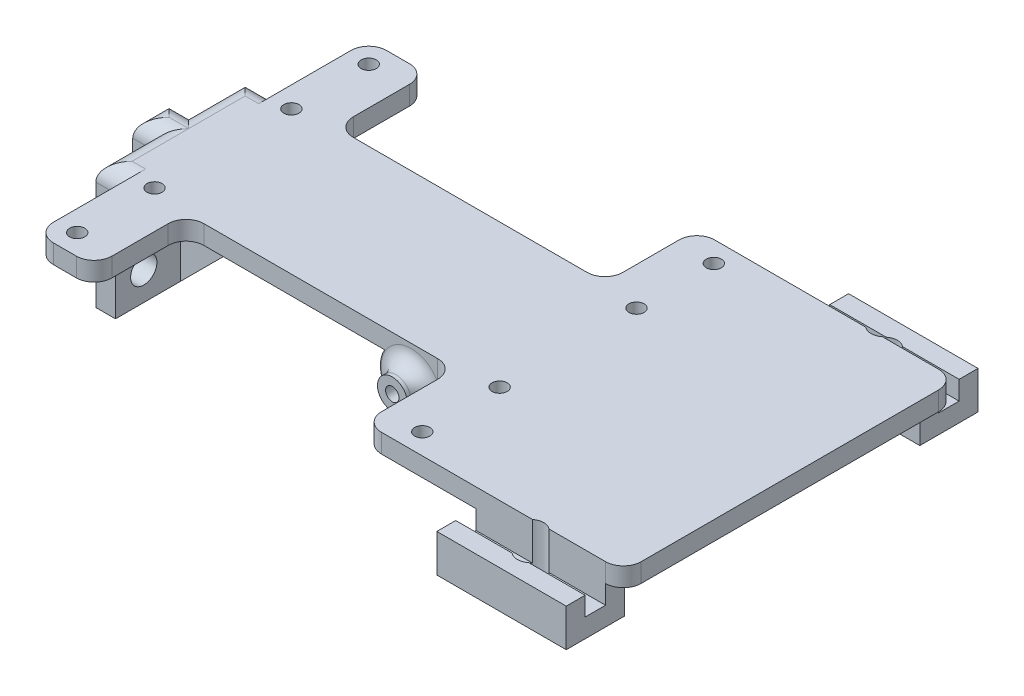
SolidWorks part; units mm, degrees
ref_plane "Front Plane" through (0, 0, 0) normal (0, 0, 1) x (1, 0, 0)
ref_plane "Top Plane" through (0, 0, 0) normal (0, 1, 0) x (1, 0, 0)
ref_plane "Right Plane" through (0, 0, 0) normal (1, 0, 0) x (0, 0, -1)
sketch "Sketch2" plane through (0, 0, 0) normal (0, 1, 0) x (1, 0, 0)
  line L0 (9.8501, 52.9996) -> (9.8501, 43.5508)
  line L1 (2.9997, 0) -> (6.8504, 0)
  line L2 (0, 2.9997) -> (0, 52.9996)
  line L3 (2.9997, 55.9994) -> (6.8504, 55.9994)
  line L4 (98.7996, 2.9997) -> (98.7996, 52.9996)
  line L5 (12.8499, 40.5511) -> (52.1513, 40.5511)
  line L6 (55.151, 43.5508) -> (55.151, 52.9996)
  line L7 (9.8501, 2.9997) -> (9.8501, 12.4485)
  line L8 (12.8499, 15.4483) -> (52.1513, 15.4483)
  line L9 (55.151, 12.4485) -> (55.151, 2.9997)
  line L10 (58.1508, 55.9994) -> (95.7999, 55.9994)
  line L11 (58.1508, 0) -> (95.7999, 0)
  arc A0 (2.9997, 0) -> (0, 2.9997) centre (2.9997, 2.9997) cw
  arc A1 (95.7999, 0) -> (98.7996, 2.9997) centre (95.7999, 2.9997) ccw
  arc A2 (95.7999, 55.9994) -> (98.7996, 52.9996) centre (95.7999, 52.9996) cw
  arc A3 (0, 52.9996) -> (2.9997, 55.9994) centre (2.9997, 52.9996) cw
  circle A4 centre (3.5001, 52.4993) radius 1.27
  circle A5 centre (61.501, 52.4993) radius 1.27
  circle A6 centre (61.501, 3.5001) radius 1.27
  circle A7 centre (3.5001, 3.5001) radius 1.27
  arc A8 (55.151, 52.9996) -> (58.1508, 55.9994) centre (58.1508, 52.9996) cw
  arc A9 (9.8501, 52.9996) -> (6.8504, 55.9994) centre (6.8504, 52.9996) ccw
  arc A10 (9.8501, 2.9997) -> (6.8504, 0) centre (6.8504, 2.9997) cw
  arc A11 (55.151, 2.9997) -> (58.1508, 0) centre (58.1508, 2.9997) ccw
  arc A12 (9.8501, 12.4485) -> (12.8499, 15.4483) centre (12.8499, 12.4485) cw
  arc A13 (52.1513, 15.4483) -> (55.151, 12.4485) centre (52.1513, 12.4485) cw
  arc A14 (52.1513, 40.5511) -> (55.151, 43.5508) centre (52.1513, 43.5508) ccw
  arc A15 (9.8501, 43.5508) -> (12.8499, 40.5511) centre (12.8499, 43.5508) ccw
  point P7 (0, 0)
  point P12 (98.7996, 55.9994)
  point P15 (0, 55.9994)
  point P34 (55.151, 55.9994)
  point P41 (55.151, 0)
  point P50 (9.8501, 40.5511)
  dimension "D3" = 2.9997
  dimension "D12" = 2.54
  dimension "D16" = 2.9997
  dimension "D1" = 55.9994
  dimension "D2" = 98.7996
  dimension "D6" = 3.5001
  dimension "D7" = 3.5001
  dimension "D8" = 3.5001
  dimension "D9" = 3.5001
  dimension "D10" = 58.0009
  dimension "D11" = 3.5001
  dimension "D13" = 25.1028
  dimension "D14" = 6.35
  dimension "D15" = 6.35
  dimension "D4" = 2
  dimension "D5" = 2
extrude "Boss-Extrude1" add sketch "Sketch2" along normal blind 3.175
sketch "Sketch3" plane through (0, 3.175, 0) normal (0, 1, 0) x (1, 0, 0)
  circle A0 centre (3.5001, 52.4993) radius 2.9997
  circle A1 centre (3.5001, 3.5001) radius 2.9997
  circle A2 centre (61.501, 52.4993) radius 2.9997
  circle A3 centre (61.501, 3.5001) radius 2.9997
  circle A4 centre (61.501, 52.4993) radius 1.27 construction
  circle A5 centre (61.501, 3.5001) radius 1.27 construction
  circle A6 centre (3.5001, 3.5001) radius 1.27 construction
  circle A7 centre (3.5001, 52.4993) radius 1.27 construction
  circle A8 centre (61.501, 52.4993) radius 1.27
  circle A9 centre (61.501, 3.5001) radius 1.27
  circle A10 centre (3.5001, 3.5001) radius 1.27
  circle A11 centre (3.5001, 52.4993) radius 1.27
  dimension "D1" = 5.9995
sketch "Sketch5" plane through (0, 0, -15.4483) normal (0, 0, 1) x (1, 0, 0)
  line L0 (0, 0) -> (98.7996, 0) construction
  line L2 (43.2316, 0) -> (52.1513, 0)
  circle A1 centre (47.6915, -2.625) radius 2.254
  circle A3 centre (47.6915, -2.625) radius 2.625 construction
  arc A4 (43.2316, 0) -> (52.1513, 0) centre (47.6915, -2.625) ccw
  dimension "D1" = 5.175
  dimension "D2" = 5.25
  dimension "D3" = 4.508
sketch "Sketch7" plane through (0, 0, -40.5511) normal (0, 0, -1) x (-1, 0, 0)
  line L0 (0, 0) -> (-98.7996, 0) construction
  line L1 (-1.8212, 0) -> (-20.8407, 0)
  line L2 (-61.8211, 0) -> (-80.8406, 0)
  arc A0 (-16.0858, -4.7549) -> (-6.5761, -4.7549) centre (-11.3309, -4.7549) ccw
  arc A1 (-76.0857, -4.7549) -> (-66.5759, -4.7549) centre (-71.3308, -4.7549) ccw
  arc A2 (-16.0858, -4.7549) -> (-20.8407, 0) centre (-20.8407, -4.7549) ccw
  arc A3 (-6.5761, -4.7549) -> (-1.8212, 0) centre (-1.8212, -4.7549) cw
  arc A4 (-66.5759, -4.7549) -> (-61.8211, 0) centre (-61.8211, -4.7549) cw
  arc A5 (-76.0857, -4.7549) -> (-80.8406, 0) centre (-80.8406, -4.7549) ccw
  circle A6 centre (-71.3308, -4.7549) radius 2.827
  circle A7 centre (-11.3309, -4.7549) radius 2.827
  dimension "D4" = 5.654
  dimension "D1" = 11.3309
  dimension "D2" = 59.9999
  dimension "D3" = 4.7549
extrude "Boss-Extrude3" add sketch "Sketch7" against normal blind 3.175
sketch "Sketch8" plane through (0, 0, -40.5511) normal (0, 0, -1) x (-1, 0, 0)
  circle A0 centre (-71.3308, -4.7549) radius 3.2385
  circle A1 centre (-11.3309, -4.7549) radius 3.2385
  circle A2 centre (-71.3308, -4.7549) radius 1.627
  circle A3 centre (-11.3309, -4.7549) radius 1.627
  dimension "D1" = 3.254
  dimension "D2" = 6.477
extrude "Boss-Extrude4" add sketch "Sketch8" along normal blind 3.175
fillet "Fillet3" radius 3.175 2 edges at (14.5694, -4.7549, -40.5511) (68.0923, -4.7549, -40.5511)
extrude "Boss-Extrude5" add sketch "Sketch5" against normal blind 3.175
sketch "Sketch9" plane through (0, 0, -15.4483) normal (0, 0, 1) x (1, 0, 0)
  circle A0 centre (47.6915, -2.625) radius 2.5
  circle A1 centre (47.6915, -2.625) radius 1.127
  dimension "D1" = 5
  dimension "D2" = 2.254
extrude "Boss-Extrude6" add sketch "Sketch9" along normal blind 3.175
sketch "Sketch10" plane through (0, 0, 0) normal (0, -1, 0) x (1, 0, 0)
  line L1 (95.7999, -55.9994) -> (74.0499, -55.9994)
  line L2 (95.7999, -55.9994) -> (95.7999, -52.8244)
  line L3 (95.7999, -52.8244) -> (74.0499, -52.8244)
  line L4 (74.0499, -55.9994) -> (74.0499, -52.8244)
  dimension "D1" = 3.175
  dimension "D2" = 21.75
extrude "Boss-Extrude7" add sketch "Sketch10" along normal blind 6.35
sketch "Sketch11" plane through (0, 0, -55.9994) normal (0, 0, -1) x (-1, 0, 0)
  line L0 (-74.0499, -6.35) -> (-74.0499, 0) construction
  line L1 (-95.7999, -6.35) -> (-74.0499, -6.35)
  line L2 (-95.7999, -6.35) -> (-95.7999, -3.175)
  line L3 (-95.7999, -3.175) -> (-74.0499, -3.175)
  line L4 (-74.0499, -6.35) -> (-74.0499, -3.175)
  dimension "D1" = 3.175
extrude "Boss-Extrude8" add sketch "Sketch11" along normal blind 6.604
sketch "Sketch12" plane through (0, -3.175, 0) normal (0, 1, 0) x (1, 0, 0)
  line L0 (95.7999, 62.6034) -> (95.7999, 55.9994) construction
  line L1 (74.0499, 62.6034) -> (95.7999, 62.6034)
  line L2 (74.0499, 62.6034) -> (74.0499, 59.4284)
  line L3 (74.0499, 59.4284) -> (95.7999, 59.4284)
  line L4 (95.7999, 62.6034) -> (95.7999, 59.4284)
  dimension "D1" = 3.175
extrude "Boss-Extrude9" add sketch "Sketch12" along normal blind 3.175
ref_plane "Plane1" through (0, 0, -27.9997) normal (0, 0, -1) x (-1, 0, 0)
mirror "Mirror1" about plane through (0, 0, -27.9997) normal (0, 0, -1) of "Boss-Extrude7", "Boss-Extrude8", "Boss-Extrude9"
sketch "Sketch13" plane through (0, -6.35, 0) normal (0, -1, 0) x (1, 0, 0)
  line L0 (95.7999, -52.8244) -> (74.0499, -52.8244) construction
  line L1 (74.0499, -52.8244) -> (74.0499, -62.6034) construction
  circle A0 centre (84.9249, -57.7139) radius 2.2098
  point P5 (84.9249, -52.8244)
  point P9 (74.0499, -57.7139)
  dimension "D1" = 4.4196
extrude "Cut-Extrude1" cut sketch "Sketch13" against normal through all
mirror "Mirror2" about plane through (0, 0, -27.9997) normal (0, 0, -1) of "Cut-Extrude1"
sketch "Sketch14" plane through (0, 0, 0) normal (-1, 0, 0) x (0, 0, 1)
  line L0 (-52.9996, 3.175) -> (-2.9997, 3.175) construction
  line L1 (-40.5511, 3.175) -> (-15.4483, 3.175)
  line L2 (-40.5511, 3.175) -> (-40.5511, 0)
  line L3 (-40.5511, 0) -> (-15.4483, 0)
  line L4 (-15.4483, 3.175) -> (-15.4483, 0)
  line L5 (-52.9996, 0) -> (-2.9997, 0) construction
  line L6 (-40.5511, 0) -> (-40.5511, -1.8716) construction
  line L8 (-15.4483, -7.8) -> (-15.4483, 0) construction
  point P10 (-40.5511, -0.9358)
extrude "Boss-Extrude10" add sketch "Sketch14" along normal blind 8.6145
sketch "Sketch15" plane through (0, 0, 0) normal (0, -1, 0) x (1, 0, 0)
  line L1 (-8.6145, -15.4483) -> (0, -15.4483) construction
  line L2 (-8.6145, -40.5511) -> (-2.0105, -40.5511)
  line L3 (-8.6145, -40.5511) -> (-8.6145, -15.4483)
  line L4 (-8.6145, -15.4483) -> (-2.0105, -15.4483)
  line L5 (-2.0105, -40.5511) -> (-2.0105, -15.4483)
  dimension "D1" = 6.604
extrude "Boss-Extrude11" add sketch "Sketch15" along normal blind 18.122 contours L5 L4 L3 L2
sketch "Sketch24" plane through (0, -18.122, 0) normal (0, -1, 0) x (1, 0, 0)
  line L0 (-2.0105, -40.5511) -> (-2.0105, -15.4483) construction
  line L1 (-2.0105, -31.0477) -> (-5.3125, -31.0477)
  line L2 (-2.0105, -31.0477) -> (-2.0105, -24.9517)
  line L3 (-2.0105, -24.9517) -> (-5.3125, -24.9517)
  line L4 (-5.3125, -31.0477) -> (-5.3125, -24.9517)
  line L5 (-8.6145, -40.5511) -> (-2.0105, -40.5511) construction
  line L6 (-8.6145, -40.5511) -> (-5.3125, -40.5511)
  line L7 (-8.6145, -40.5511) -> (-8.6145, -31.0477)
  line L8 (-8.6145, -31.0477) -> (-5.3125, -31.0477)
  line L9 (-5.3125, -40.5511) -> (-5.3125, -31.0477)
  line L10 (-5.3125, -24.9517) -> (-8.6145, -24.9517)
  line L11 (-5.3125, -24.9517) -> (-5.3125, -15.4483)
  line L12 (-5.3125, -15.4483) -> (-8.6145, -15.4483)
  line L13 (-8.6145, -24.9517) -> (-8.6145, -15.4483)
  line L14 (-8.6145, -15.4483) -> (-2.0105, -15.4483) construction
  point P18 (-5.3125, -40.5511)
  dimension "D1" = 6.096
extrude "Cut-Extrude2" cut sketch "Sketch24" against normal through all contours L9 L8 M5 M8 | L10 L11 M7 M8
sketch "Sketch25" plane through (-5.3125, 0, 0) normal (-1, 0, 0) x (0, 0, 1)
  line L0 (-40.5511, -18.122) -> (-31.0477, -18.122) construction
  line L1 (-24.9517, -18.122) -> (-15.4483, -18.122) construction
  circle A0 centre (-35.7994, -13.3595) radius 2.2098
  circle A1 centre (-20.2, -13.3595) radius 2.2098
  point P7 (-35.7994, -18.122)
  point P11 (-20.2, -18.122)
  dimension "D1" = 4.4196
  dimension "D2" = 4.7625
extrude "Cut-Extrude3" cut sketch "Sketch25" against normal up to next
sketch "Sketch26" plane through (0, 0, -27.9997) normal (0, 0, -1) x (-1, 0, 0)
  line L0 (2.0105, -18.122) -> (2.0105, 0) construction
  line L1 (2.0105, -18.122) -> (2.0105, 0)
  line L2 (2.0105, 0) -> (-16.1116, 0)
  line L3 (2.0105, -18.122) -> (-16.1116, 0)
extrude "Boss-Extrude16" add sketch "Sketch26" along normal mid plane 3.175
fillet "Fillet6" radius 3.048 10 edges at (16.1116, 0, -27.9997) (-2.0105, 0, -35.0691) (-2.0105, 0, -20.9302) (-5.3125, 3.175, -35.7994) (-5.3125, 3.175, -20.2) (-8.6145, 3.175, -27.9997) (-6.9635, 3.175, -24.9517) (-6.9635, 3.175, -31.0477) (-2.6562, 3.175, -15.4483) (-2.6562, 3.175, -40.5511)
sketch "Sketch27" plane through (0, 3.175, 0) normal (0, 1, 0) x (1, 0, 0)
  circle A0 centre (3.5001, 16.4997) radius 2.54
  circle A1 centre (3.5001, 16.4997) radius 1.27
  circle A2 centre (61.5001, 16.4997) radius 1.27
  circle A3 centre (61.5001, 16.4997) radius 2.54
  circle A4 centre (61.5007, 39.4997) radius 1.27
  circle A5 centre (61.5007, 39.4997) radius 2.54
  circle A6 centre (3.5007, 39.4997) radius 1.27
  circle A7 centre (3.5007, 39.4997) radius 2.54
extrude "Cut-Extrude4" cut sketch "Sketch27" against normal through all contours A1 | A6 | A4 | A2
fillet "Fillet7" radius 2.54 1 edges at (45.1915, -2.625, -15.4483)
equation "\"D8@Sketch27\"=\"D7@Sketch27\""
